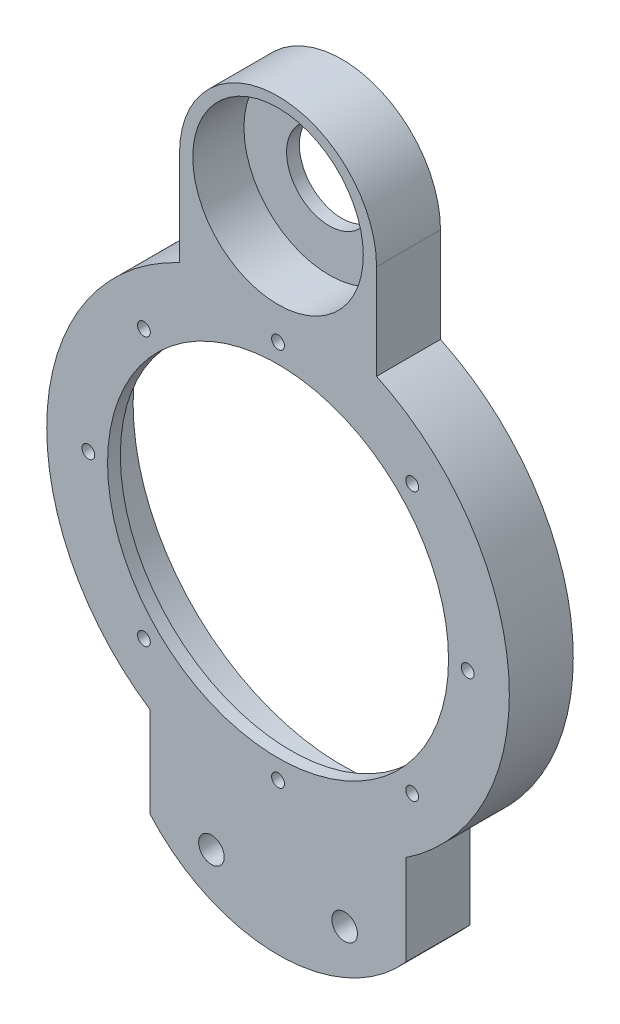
SolidWorks part; units mm, degrees
ref_plane "Front Plane" through (0, 0, 0) normal (0, 0, 1) x (1, 0, 0)
ref_plane "Top Plane" through (0, 0, 0) normal (0, 1, 0) x (1, 0, 0)
ref_plane "Right Plane" through (0, 0, 0) normal (1, 0, 0) x (0, 0, -1)
sketch "Sketch2" plane through (0, 0, 0) normal (0, 0, 1) x (1, 0, 0)
  line L0 (30, 66.4575) -> (30, 138.5775)
  line L2 (0, 0) -> (0, 21.2346)
  line L4 (60, 0) -> (60, 21.2346)
  line L9 (6.8855, 137.8208) -> (6.8855, 115.5577)
  line L10 (30, 66.4575) -> (30, -13.5425) construction
  line L11 (0, 10.6173) -> (60, 10.6173) construction
  line L12 (14.375, 0) -> (45.625, 0) construction
  line L13 (53.1145, 115.5577) -> (53.1145, 137.8208)
  line L14 (30, 160.9353) -> (30, -13.5425) construction
  arc A0 (0, 0) -> (60, 0) centre (30, 26.4575) ccw
  circle A1 centre (30, 66.4575) radius 49
  circle A2 centre (30, 138.5775) radius 20
  arc A3 (6.8855, 137.8208) -> (53.1145, 137.8208) centre (30, 137.8208) cw
  arc A5 (6.8855, 115.5577) -> (0, 21.2346) centre (30, 66.4575) ccw
  arc A6 (60, 21.2346) -> (53.1145, 115.5577) centre (30, 66.4575) ccw
  circle A7 centre (14.375, 0) radius 3
  circle A8 centre (45.625, 0) radius 3
  circle A9 centre (30, 66.4575) radius 40
  dimension "D2" = 98
  dimension "D4" = 40
  dimension "D3" = 40
  dimension "D5" = 80
  dimension "D6" = 6
  dimension "D1" = 72.12
  dimension "D7" = 31.25
extrude "Boss-Extrude5" add sketch "Sketch2" along normal blind 15 contours A3 L13 A6 L4 A0 L2 A5 L9 | A2 | A9 | A7 | A8
sketch "Sketch7" plane through (0, 0, 15) normal (0, 0, 1) x (1, 0, 0)
  line L0 (30, 115.4575) -> (30, 107.4575) construction
  line L1 (30, 111.4575) -> (30, 66.4575) construction
  circle A0 centre (30, 66.4575) radius 49
  circle A2 centre (30, 111.4575) radius 1.5
  circle A3 centre (61.8198, 98.2773) radius 1.5
  circle A4 centre (75, 66.4575) radius 1.5
  circle A5 centre (61.8198, 34.6377) radius 1.5
  circle A6 centre (30, 21.4575) radius 1.5
  circle A7 centre (-1.8198, 34.6377) radius 1.5
  circle A8 centre (-15, 66.4575) radius 1.5
  circle A9 centre (-1.8198, 98.2773) radius 1.5
  dimension "D1" = 98
  dimension "D2" = 3
  dimension "D3" = 8
sketch "Sketch21" plane through (0, 0, 0) normal (0, 0, -1) x (-1, 0, 0)
  circle A0 centre (-30, 138.5775) radius 10
  circle A1 centre (-30, 138.5775) radius 20
extrude "Boss-Extrude6" add sketch "Sketch21" against normal blind 3
sketch "Sketch22" plane through (0, 0, 0) normal (0, 0, -1) x (-1, 0, 0)
  circle A0 centre (-30, 66.4575) radius 49
extrude "Cut-Extrude1" cut sketch "Sketch22" against normal blind 12
sketch "Sketch23" plane through (0, 0, 12) normal (0, 0, -1) x (-1, 0, 0)
  circle A0 centre (-30, 66.4575) radius 44.5
  circle A1 centre (-30, 110.9575) radius 1.5
  circle A2 centre (1.4663, 97.9238) radius 1.5
  circle A3 centre (14.5, 66.4575) radius 1.5
  circle A4 centre (1.4663, 34.9913) radius 1.5
  circle A5 centre (-30, 21.9575) radius 1.5
  circle A6 centre (-61.4663, 34.9913) radius 1.5
  circle A7 centre (-74.5, 66.4575) radius 1.5
  circle A8 centre (-61.4663, 97.9238) radius 1.5
  dimension "D1" = 8
extrude "Cut-Extrude3" cut sketch "Sketch23" against normal through all contours A8 | A1 | A2 | A3 | A4 | A5 | A6 | A7
